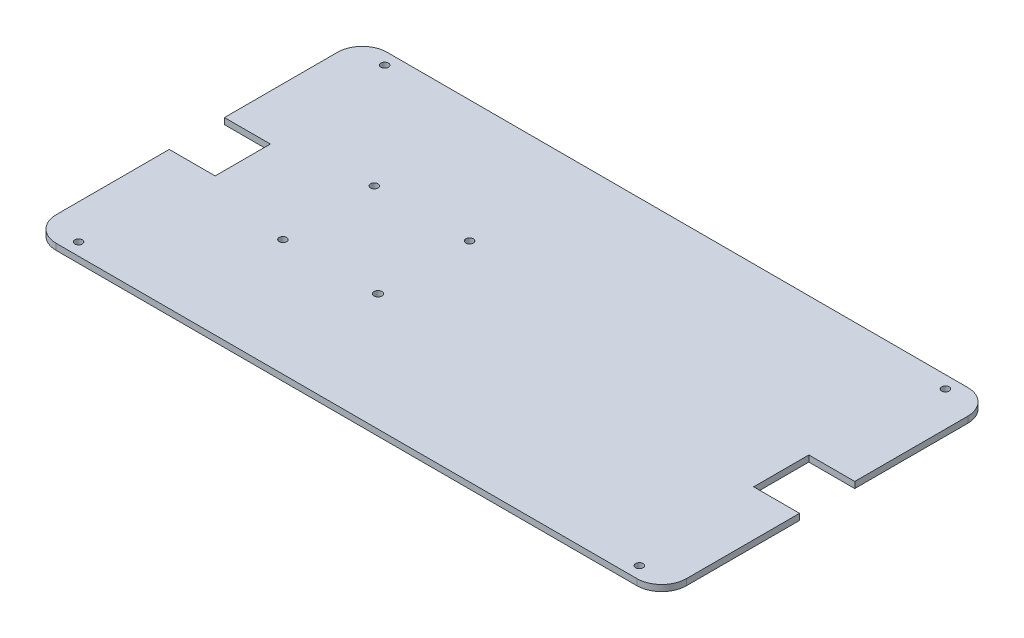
SolidWorks part; units mm, degrees
ref_plane "Front Plane" through (0, 0, 0) normal (0, 0, 1) x (1, 0, 0)
ref_plane "Top Plane" through (0, 0, 0) normal (0, 1, 0) x (1, 0, 0)
ref_plane "Right Plane" through (0, 0, 0) normal (1, 0, 0) x (0, 0, -1)
sketch "Sketch1" plane through (0, 0, 0) normal (0, 1, 0) x (1, 0, 0)
  line L1 (-127, 66.675) -> (127, 66.675)
  line L2 (-127, 66.675) -> (-127, -66.675)
  line L3 (-127, -66.675) -> (127, -66.675)
  line L4 (127, 66.675) -> (127, -66.675)
  line L5 (-127, 66.675) -> (127, -66.675) construction
  line L6 (-127, -66.675) -> (127, 66.675) construction
  point P0 (0, 0)
  dimension "D1" = 254
  dimension "D2" = 133.35
extrude "Boss-Extrude1" add sketch "Sketch1" along normal blind 2.5
fillet "Fillet1" radius 10 4 edges at (127, 1.25, 66.675) (127, 1.25, -66.675) (-127, 1.25, -66.675) (-127, 1.25, 66.675)
sketch "Sketch2" plane through (0, 0, 0) normal (0, 1, 0) x (1, 0, 0)
  line L0 (117, 66.675) -> (-117, 66.675) construction
  line L1 (-117, -66.675) -> (117, -66.675) construction
  line L2 (-127, 56.675) -> (-127, -56.675) construction
  line L3 (127, -56.675) -> (127, 56.675) construction
  circle A0 centre (-113, 61.675) radius 1.5
  circle A1 centre (-113, -61.675) radius 1.5
  circle A2 centre (113, 61.675) radius 1.5
  circle A3 centre (113, -61.675) radius 1.5
  dimension "D1" = 3
  dimension "D2" = 3
  dimension "D3" = 3
  dimension "D4" = 3
  dimension "D5" = 5
  dimension "D6" = 5
  dimension "D7" = 5
  dimension "D8" = 5
  dimension "D9" = 14
  dimension "D10" = 14
  dimension "D11" = 14
  dimension "D12" = 14
extrude "Cut-Extrude4" cut sketch "Sketch2" against normal blind 4.5 and the other way blind 8
sketch "Sketch3" plane through (0, 2.5, 0) normal (0, 1, 0) x (1, 0, 0)
  line L0 (0, 66.675) -> (0, -66.675) construction
  line L1 (117, 66.675) -> (-117, 66.675) construction
  line L2 (-117, -66.675) -> (117, -66.675) construction
  line L3 (0, 0) -> (-127, 0) construction
  line L4 (-127, 56.675) -> (-127, -56.675) construction
  line L5 (-127, 0) -> (127, 0) construction
  line L6 (127, -56.675) -> (127, 56.675) construction
  line L7 (-127, 11.125) -> (-127, -11.125)
  line L8 (-127, 11.125) -> (-108.5, 11.125)
  line L10 (-127, -11.125) -> (-108.5, -11.125)
  line L11 (127, 11.125) -> (127, -11.125)
  line L12 (-108.5, 11.125) -> (-108.5, -11.125)
  line L13 (-145.5, 11.125) -> (-108.5, -11.125) construction
  line L14 (108.5, 11.125) -> (127, 11.125)
  line L15 (108.5, 11.125) -> (108.5, -11.125)
  line L16 (108.5, -11.125) -> (127, -11.125)
  line L18 (108.5, 11.125) -> (127, 0) construction
  line L19 (108.5, -11.125) -> (127, 0) construction
  line L20 (-145.5, -11.125) -> (-108.5, 11.125) construction
  dimension "D1" = 22.25
  dimension "D3" = 22.25
  dimension "D4" = 37
extrude "Cut-Extrude5" cut sketch "Sketch3" against normal blind 10
sketch "Sketch4" plane through (0, 2.5, 0) normal (0, 1, 0) x (1, 0, 0)
  line L0 (0, 0) -> (-108.5, 0) construction
  line L3 (-108.5, -11.125) -> (-108.5, 11.125) construction
  line L4 (-32.2746, 18.9078) -> (-33.8746, 18.9078) construction
  line L11 (-33.8746, 18.9078) -> (-33.8746, 20.5078) construction
  line L12 (-75.2746, 18.9078) -> (-73.6746, 18.9078) construction
  line L13 (-73.6746, 18.9078) -> (-73.6746, 20.5078) construction
  line L14 (-75.2746, -20.8922) -> (-73.6746, -20.8922) construction
  line L15 (-73.6746, -20.8922) -> (-73.6746, -22.4922) construction
  line L16 (-32.2746, -20.8922) -> (-33.8746, -20.8922) construction
  line L17 (-33.8746, -20.8922) -> (-33.8746, -22.4922) construction
  circle A0 centre (-72.9711, 17.4707) radius 1.5
  circle A1 centre (-34.566, -19.4493) radius 1.6
  circle A2 centre (-34.548, 17.4564) radius 1.5
  circle A5 centre (-72.6213, -19.6878) radius 1.5
  point P4 (-54.25, 0)
  dimension "D7" = 3
  dimension "D11" = 3
  dimension "D12" = 1.6
  dimension "D13" = 3
  dimension "D3" = 1.6
  dimension "D4" = 1.6
  dimension "D5" = 1.6
  dimension "D6" = 1.6
  dimension "D8" = 1.6
  dimension "D9" = 1.6
  dimension "D10" = 1.6
extrude "Cut-Extrude6" cut sketch "Sketch4" against normal blind 10
